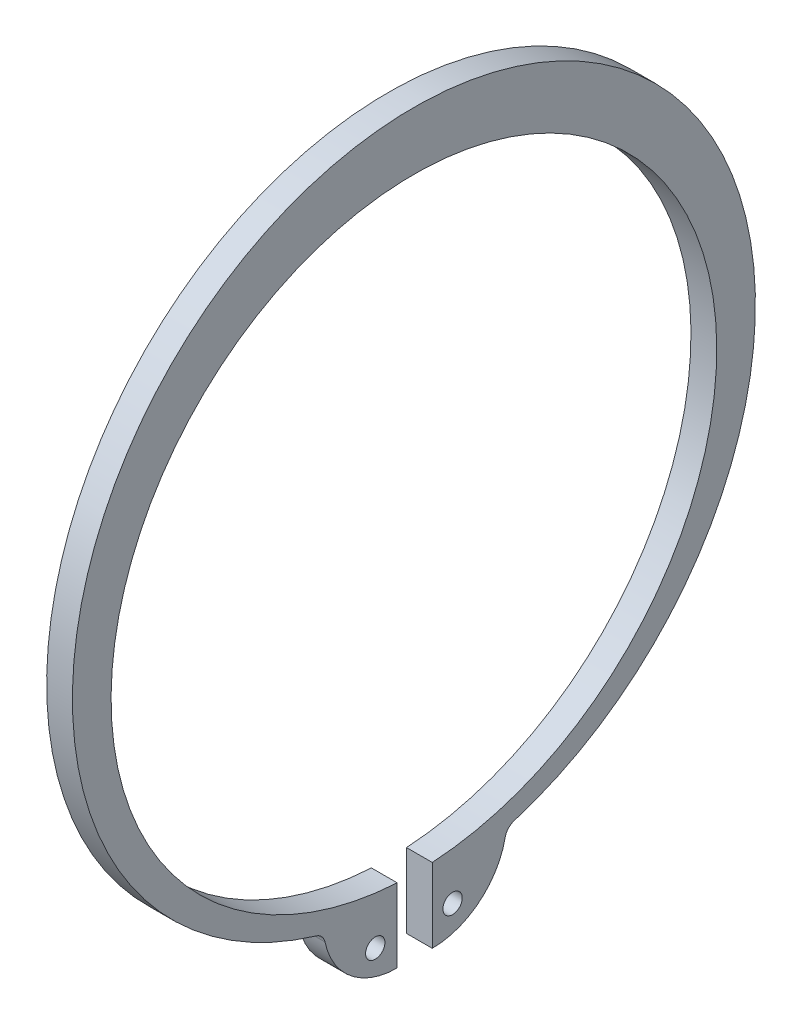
SolidWorks part; units mm, degrees
ref_plane "Plan1" through (0, 0, 0) normal (0, 0, 1) x (1, 0, 0)
ref_plane "Plan2" through (0, 0, 0) normal (0, 1, 0) x (1, 0, 0)
ref_plane "Plan3" through (0, 0, 0) normal (1, 0, 0) x (0, 0, -1)
sketch "Esquisse1" plane through (0, 0, 0) normal (1, 0, 0) x (0, 0, -1)
  line L0 (-1.298, -23.4641) -> (-1.298, -29.1891)
  line L1 (1.4242, -23.4568) -> (1.4242, -29.2306)
  arc A0 (1.4242, -23.4568) -> (-1.298, -23.4641) centre (0, 0) ccw
  arc A1 (-6.9006, -24.6414) -> (-1.298, -29.1891) centre (-1.298, -23.4641) ccw
  arc A3 (7.7721, -23.8346) -> (7.085, -24.5937) centre (8.0654, -24.7907) ccw
  circle A4 centre (-3, -27) radius 0.75
  arc A5 (1.4242, -29.2306) -> (7.085, -24.5937) centre (1.4242, -23.4568) ccw
  arc A6 (7.7721, -23.8346) -> (-7.5927, -23.889) centre (0, 1.5) ccw
  circle A7 centre (3, -27) radius 0.75
  arc A8 (-7.5927, -23.889) -> (-6.9006, -24.6414) centre (-7.8792, -24.8471) cw
  dimension "D2" = 47
  dimension "D3" = 5.7738
  dimension "D7" = 3
  dimension "D4" = 1.5
  dimension "D5" = 1.5
  dimension "D9" = 26.5
  dimension "D11" = 1
  dimension "D1" = 1.5
  dimension "D8" = 3
  dimension "D10" = 27
  dimension "D12" = 1.298
  dimension "D13" = 27
extrude "Base-Extrusion" add sketch "Esquisse1" along normal blind 2
